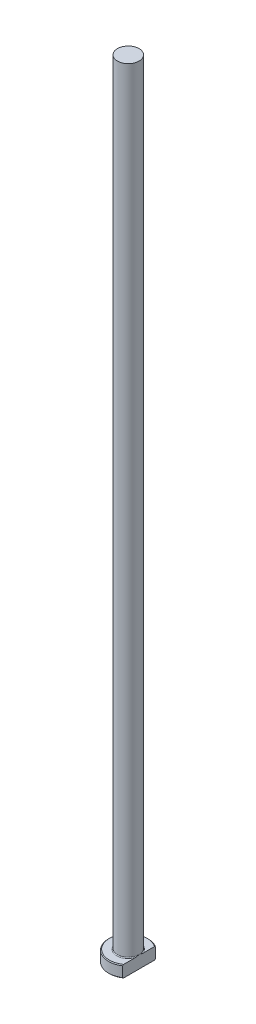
SolidWorks part; units mm, degrees
ref_plane "Front Plane" through (0, 0, 0) normal (0, 0, 1) x (1, 0, 0)
ref_plane "Top Plane" through (0, 0, 0) normal (0, 1, 0) x (1, 0, 0)
ref_plane "Right Plane" through (0, 0, 0) normal (1, 0, 0) x (0, 0, -1)
sketch "Sketch1" plane through (0, 0, 0) normal (0, 0, 1) x (1, 0, 0)
  line L0 (0, 259.9588) -> (0, -15.1925) construction
  line L1 (0, 0) -> (-5, 0)
  line L2 (-5, 0) -> (-5, 3)
  line L3 (-5, 3) -> (-2.75, 3)
  line L4 (-2.75, 3) -> (-2.75, 200)
  line L5 (-2.75, 200) -> (0, 200)
  line L6 (0, 200) -> (0, 0)
  dimension "L" = 200
  dimension "H" = 10
  dimension "T" = 3
  dimension "D" = 5.5
revolve "Revolve1" add sketch "Sketch1" angle 360 about L0
chamfer "Chamfer1" distance 0.2 angle 45 2 edges at (0, 3, 5) (0, 0, 5)
fillet "Fillet1" radius 0.2 1 edges at (0, 3, 2.75)
sketch "Sketch2" plane through (0, 0, 0) normal (0, 1, 0) x (1, 0, 0)
  line L0 (2.75, 4.1758) -> (2.75, -4.1758)
  circle A0 centre (0, 0) radius 5 construction
  arc A1 (2.75, -4.1758) -> (2.75, 4.1758) centre (0, 0) ccw
  circle A2 centre (0, 0) radius 2.75 construction
extrude "KEY" cut sketch "Sketch2" along normal through all
